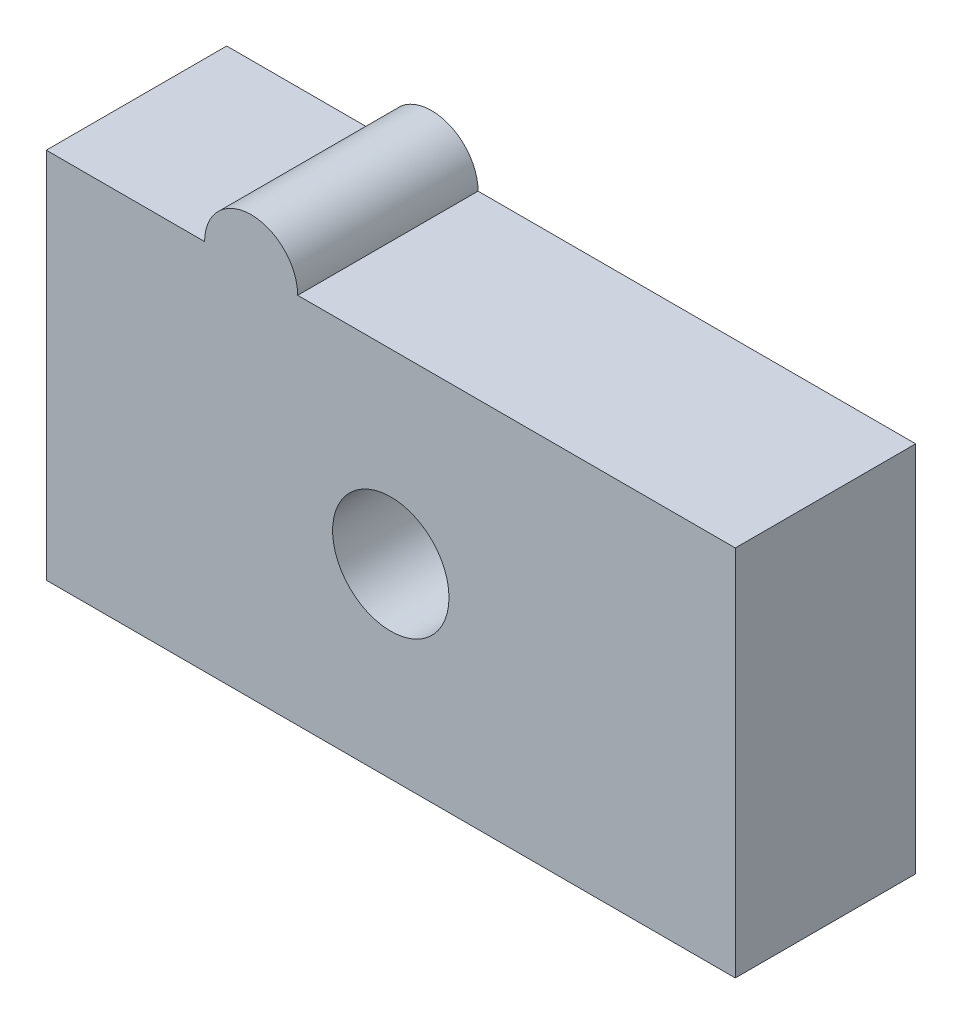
SolidWorks part; units mm, degrees
ref_plane "XZ (Face)" through (0, 0, 0) normal (0, 0, 1) x (1, 0, 0)
ref_plane "XY (Dessus)" through (0, 0, 0) normal (0, 1, 0) x (1, 0, 0)
ref_plane "YZ (Droite)" through (0, 0, 0) normal (1, 0, 0) x (0, 0, -1)
sketch "Esquisse1" plane through (0, 0, 0) normal (0, 0, 1) x (1, 0, 0)
  line L0 (-2, -10) -> (7.4, -10) construction
  line L1 (-7.4, -10) -> (-4, -10) construction
  line L2 (-7.4, -18) -> (-7.4, -10) construction
  line L3 (7.4, -18) -> (7.4, -10) construction
  line L4 (-6.5, -18) -> (6.5, -18) construction
  line L5 (-2, -10) -> (7.4, -10)
  line L6 (-7.4, -10) -> (-4, -10)
  line L7 (-7.4, -18) -> (-7.4, -10)
  line L8 (7.4, -18) -> (7.4, -10)
  line L9 (-7.4, -18) -> (7.4, -18)
  arc A0 (-2, -10) -> (-4, -10) centre (-3, -10) ccw construction
  arc A1 (-2, -10) -> (-4, -10) centre (-3, -10) ccw
extrude "Base-Extrusion" add sketch "Esquisse1" along normal blind 3.875
sketch "Esquisse2" plane through (0, 0, 0) normal (0, 0, -1) x (-1, 0, 0)
  circle A0 centre (-4.9938, -11.6952) radius 1 construction
  circle A1 centre (-4.9938, -11.6952) radius 1
  circle A2 centre (4.9938, -16.3048) radius 1 construction
  circle A3 centre (4.9938, -16.3048) radius 1
extrude "Enlèv. mat.-Extru.1" cut sketch "Esquisse2" against normal blind 3
sketch "Esquisse3" plane through (0, 0, 3.875) normal (0, 0, 1) x (1, 0, 0)
  circle A0 centre (0, -14) radius 1.25
  dimension "D1" = 2.5
extrude "Enlèv. mat.-Extru.2" cut sketch "Esquisse3" against normal through all
